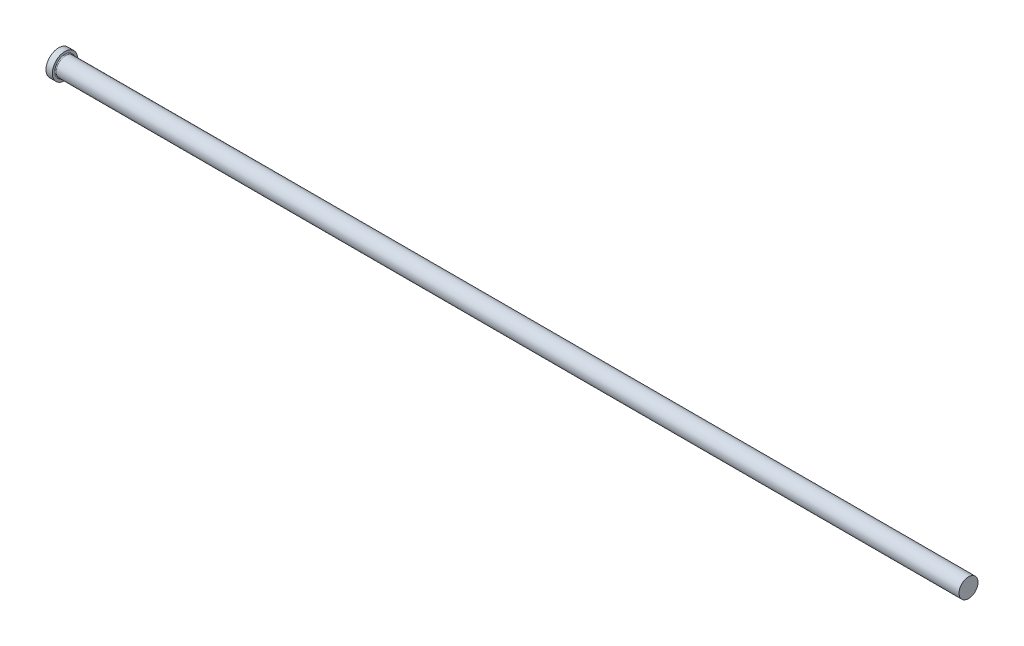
SolidWorks part; units mm, degrees
ref_plane "Front Plane" through (0, 0, 0) normal (0, 0, 1) x (1, 0, 0)
ref_plane "Top Plane" through (0, 0, 0) normal (0, 1, 0) x (1, 0, 0)
ref_plane "Right Plane" through (0, 0, 0) normal (1, 0, 0) x (0, 0, -1)
sketch "Sketch1" plane through (0, 0, 0) normal (0, 0, 1) x (1, 0, 0)
  line L0 (0, 0) -> (0, 12.7)
  line L1 (0, 12.7) -> (6.35, 12.7)
  line L2 (6.35, 12.7) -> (6.35, 10.3061)
  line L3 (7.1374, 9.5186) -> (914.4, 9.5186)
  line L4 (914.4, 9.5186) -> (914.4, 0)
  line L5 (914.4, 0) -> (0, 0)
  line L6 (914.4, 0) -> (0, 0) construction
  line L7 (0, 0) -> (-10.4771, 0) construction
  line L8 (914.4, 0) -> (1002.3976, 0) construction
  arc A0 (7.1374, 9.5186) -> (6.35, 10.3061) centre (7.1374, 10.3061) cw
  dimension "D1" = 0.7874
  dimension "HeadDia" = 25.4
  dimension "HeadThickness" = 6.35
  dimension "PinDia" = 19.0373
  dimension "overall" = 914.4
revolve "PIN" add sketch "Sketch1" angle 360 about L6
